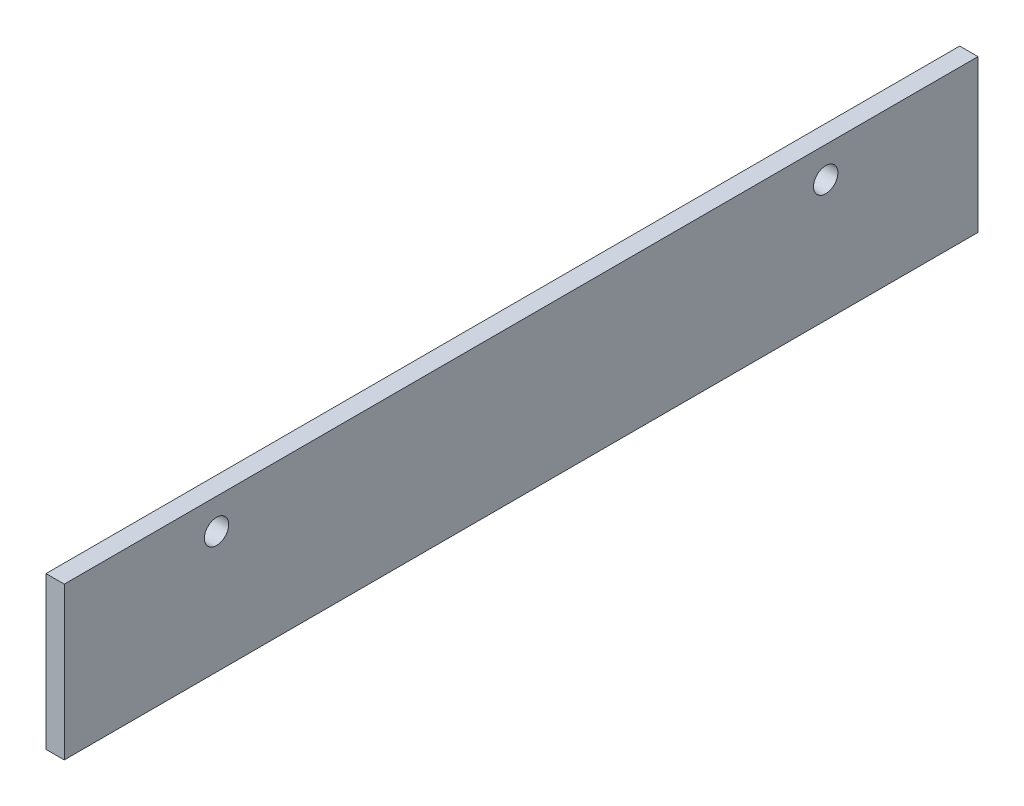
SolidWorks part; units mm, degrees
ref_plane "Front Plane" through (0, 0, 0) normal (0, 0, 1) x (1, 0, 0)
ref_plane "Top Plane" through (0, 0, 0) normal (0, 1, 0) x (1, 0, 0)
ref_plane "Right Plane" through (0, 0, 0) normal (1, 0, 0) x (0, 0, -1)
sketch "Sketch1" plane through (0, 0, 0) normal (1, 0, 0) x (0, 0, -1)
  line L0 (0, 25) -> (0, -25) construction
  line L1 (-150, 25) -> (150, 25)
  line L2 (-150, 25) -> (-150, -25)
  line L3 (-150, -25) -> (150, -25)
  line L4 (150, 25) -> (150, -25)
  line L5 (-150, 0) -> (150, 0) construction
  dimension "D1" = 50
  dimension "D2" = 300
extrude "Extrude1" add sketch "Sketch1" along normal blind 6
sketch "Sketch2" plane through (6, 0, 0) normal (1, 0, 0) x (0, 0, -1)
  line L0 (0, 25) -> (0, -30) construction
  line L1 (150, 25) -> (-150, 25) construction
  circle A0 centre (-100, 15) radius 4
  circle A1 centre (100, 15) radius 4
  dimension "D2" = 8
  dimension "D1" = 100
  dimension "D3" = 10
extrude "Cut-Extrude1" cut sketch "Sketch2" against normal blind 6
